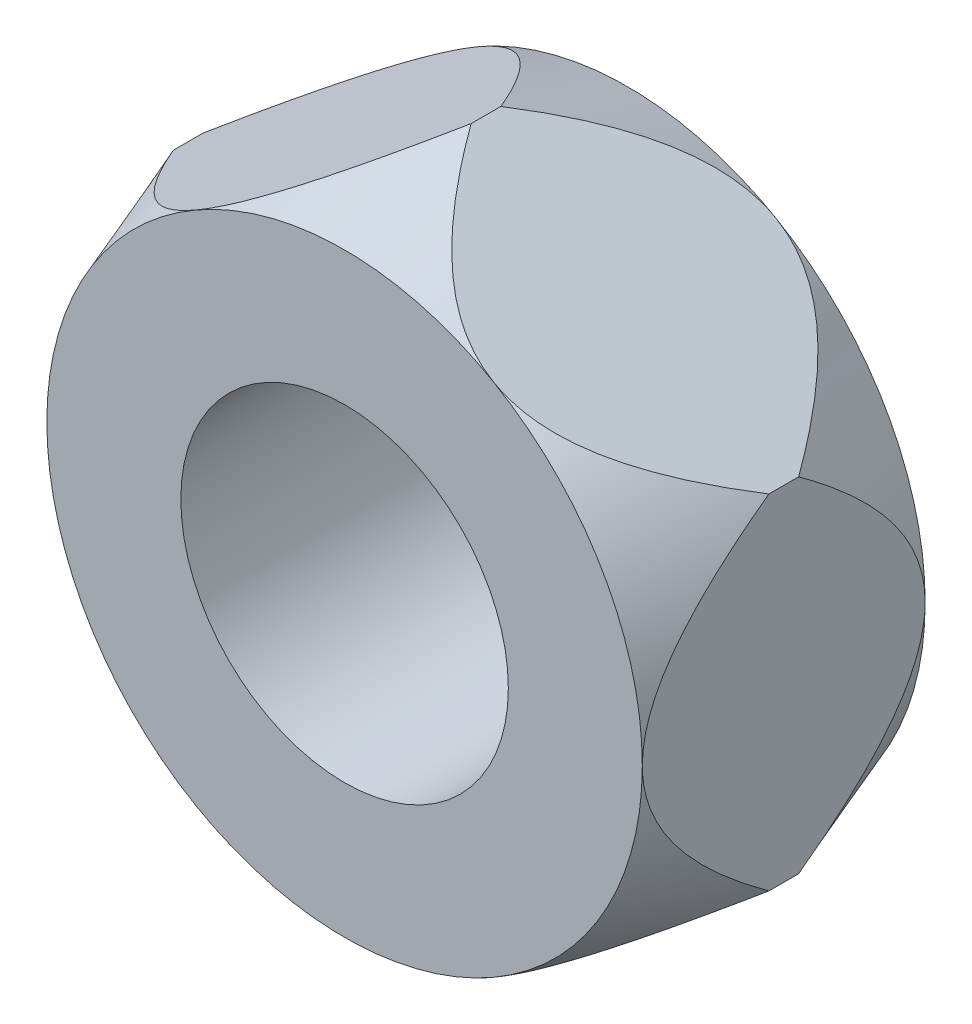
SolidWorks part; units mm, degrees
ref_plane "Front Plane" through (0, 0, 0) normal (0, 0, 1) x (1, 0, 0)
ref_plane "Top Plane" through (0, 0, 0) normal (0, 1, 0) x (1, 0, 0)
ref_plane "Right Plane" through (0, 0, 0) normal (1, 0, 0) x (0, 0, -1)
sketch "Sketch1" plane through (0, 0, 0) normal (0, 0, 1) x (1, 0, 0)
  line L1 (0, 5.7735) -> (-5, 2.8868)
  line L2 (-5, 2.8868) -> (-5, -2.8868)
  line L3 (-5, -2.8868) -> (0, -5.7735)
  line L4 (0, -5.7735) -> (5, -2.8868)
  line L5 (5, -2.8868) -> (5, 2.8868)
  line L6 (5, 2.8868) -> (0, 5.7735)
  circle A0 centre (0, 0) radius 5 construction
extrude "Boss-Extrude1" add sketch "Sketch1" along normal blind 4.75
sketch "Sketch2" plane through (0, 0, 4.75) normal (0, 0, 1) x (1, 0, 0)
  circle A0 centre (0, 0) radius 5
extrude "Cut-Extrude1" cut sketch "Sketch2" against normal through all draft 20 flip side to cut
sketch "Sketch3" plane through (0, 0, 0) normal (0, 0, -1) x (-1, 0, 0)
  circle A0 centre (0, 0) radius 5
extrude "Cut-Extrude2" cut sketch "Sketch3" against normal through all draft 20 flip side to cut
sketch "Sketch4" plane through (0, 0, 0) normal (0, 0, -1) x (-1, 0, 0)
  circle A0 centre (0, 0) radius 2.75
extrude "Cut-Extrude3" cut sketch "Sketch4" against normal blind 4.75
